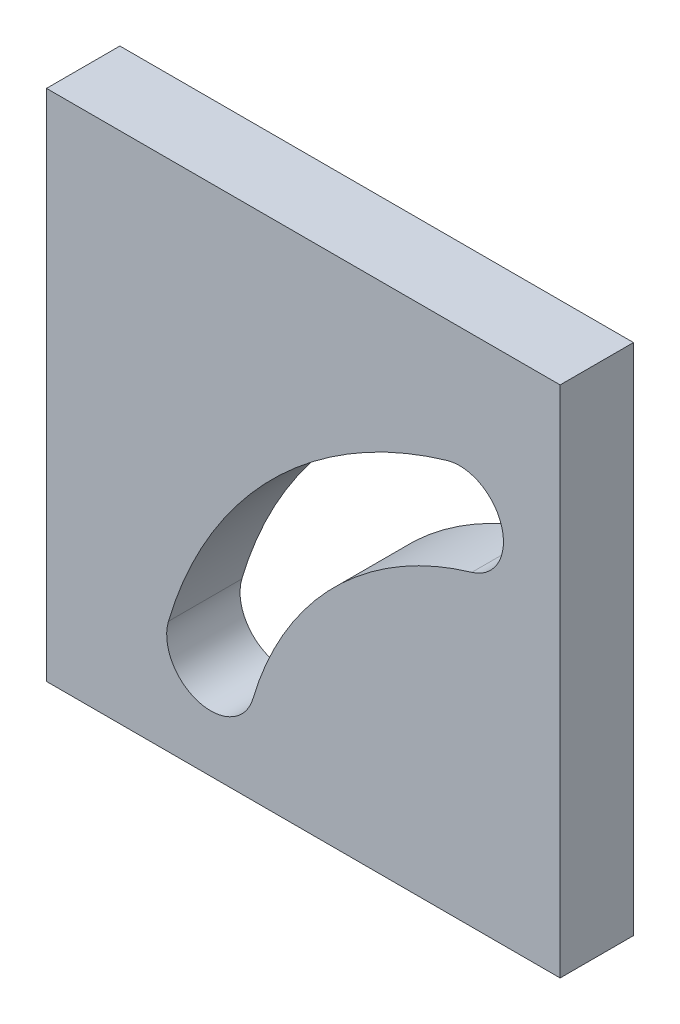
SolidWorks part; units mm, degrees
ref_plane "Płaszczyzna przednia" through (0, 0, 0) normal (0, 0, 1) x (1, 0, 0)
ref_plane "Płaszczyzna górna" through (0, 0, 0) normal (0, 1, 0) x (1, 0, 0)
ref_plane "Płaszczyzna prawa" through (0, 0, 0) normal (1, 0, 0) x (0, 0, -1)
sketch "Szkic1" plane through (0, 0, 0) normal (0, 0, 1) x (1, 0, 0)
  line L1 (35, -35) -> (-35, -35)
  line L2 (35, -35) -> (35, 35)
  line L3 (35, 35) -> (-35, 35)
  line L4 (-35, -35) -> (-35, 35)
  line L5 (35, -35) -> (-35, 35) construction
  line L6 (35, 35) -> (-35, -35) construction
  arc A0 (21.2784, 12.6221) -> (-12.6221, -21.2784) centre (35.3553, -35.3553) ccw construction
  arc A1 (19.5891, 18.3794) -> (-18.3794, -19.5891) centre (35.3553, -35.3553) ccw
  arc A2 (22.9676, 6.8648) -> (-6.8648, -22.9676) centre (35.3553, -35.3553) ccw
  arc A3 (22.9676, 6.8648) -> (19.5891, 18.3794) centre (21.2784, 12.6221) ccw
  arc A4 (-18.3794, -19.5891) -> (-6.8648, -22.9676) centre (-12.6221, -21.2784) ccw
  point P0 (0, 0)
  point P9 (0, 0)
  dimension "D3" = 6
  dimension "D4" = 50
  dimension "D1" = 70
  dimension "D2" = 50
extrude "Dodanie-wyciągnięcie1" add sketch "Szkic1" along normal blind 10
